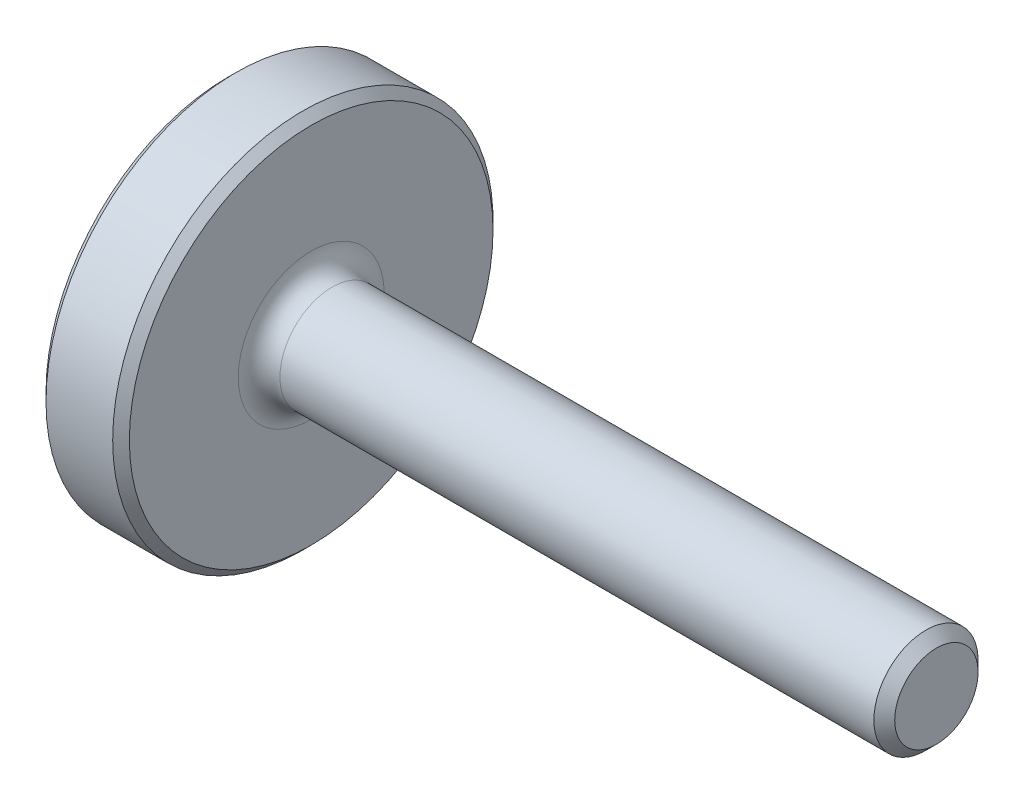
SolidWorks part; units mm, degrees
ref_plane "Plane1" through (0, 0, 0) normal (0, 0, 1) x (1, 0, 0)
ref_plane "Plane2" through (0, 0, 0) normal (0, 1, 0) x (1, 0, 0)
ref_plane "Plane3" through (0, 0, 0) normal (1, 0, 0) x (0, 0, -1)
sketch "BodySke" plane through (0, 0, 0) normal (0, 0, 1) x (1, 0, 0)
  line L0 (67, 5) -> (68, 4)
  line L1 (0, 0) -> (0, 17.45)
  line L2 (-11.4008, 0) -> (80.9761, 0) construction
  line L3 (68, 0) -> (0, 0)
  line L5 (68, 4) -> (68, 0)
  line L6 (0.8, 18.25) -> (7.2, 18.25)
  line L7 (4, 31.75) -> (4, -6.35) construction
  line L8 (0.8, 18.25) -> (0, 17.45)
  line L9 (10, 6.5875) -> (10, -2.9375) construction
  line L10 (18, 6.35) -> (18, -3.175) construction
  line L11 (7.2, 18.25) -> (8, 17.45)
  line L14 (8, 5) -> (67, 5)
  line L15 (8, 5) -> (8, 17.45)
  point P9 (68, 5)
  dimension "D1" = 45
  dimension "Head_ht" = 8
  dimension "D4" = 45
  dimension "Diameter" = 10
  dimension "Length" = 60
  dimension "Head_dia" = 36.5
  dimension "Advance" = 2
  dimension "Thread_nom" = 50
  dimension "Chamfer" = 0.8
  dimension "Minor_dia" = 8
revolve "Base-Revolve" add sketch "BodySke"
fillet "Fillet2" radius 2 1 edges at (8, 0, 5)
sketch "UcutSke" plane through (0, 0, 0) normal (0, 0, 1) x (1, 0, 0)
  line L0 (14, 5) -> (14, 4.5)
  line L1 (14.5, 4) -> (15.134, 4)
  line L2 (15.384, 4.067) -> (17, 5)
  line L3 (-5.0411, 0) -> (27.7823, 0) construction
  line L5 (14, 5) -> (17, 5)
  line L6 (8, -17.45) -> (8, 17.45) construction
  arc A0 (14.5, 4) -> (14, 4.5) centre (14.5, 4.5) cw
  arc A1 (15.384, 4.067) -> (15.134, 4) centre (15.134, 4.5) cw
  dimension "UcutRad" = 0.5
  dimension "D2" = 30
  dimension "Minor" = 8
  dimension "Diameter" = 10
  dimension "Neck" = 3
  dimension "e" = 6
revolve "UnderCut" [suppressed] cut sketch "UcutSke" angle 360 about L3
sketch "ThdSchSke" plane through (0, 0, 0) normal (0, 0, 1) x (1, 0, 0)
  line L0 (17, -4) -> (16.2998, -5)
  line L1 (17, -4) -> (17.7002, -5)
  line L2 (17.7002, -5) -> (17.7002, -6.25)
  line L3 (-3.175, 0) -> (5.1513, 0) construction
  line L5 (17.7002, -6.25) -> (16.2998, -6.25)
  line L6 (16.2998, -6.25) -> (16.2998, -5)
  line L8 (8, -17.45) -> (8, 17.45) construction
  dimension "Thread_minor" = 8
  dimension "Diameter" = 10
  dimension "Start" = 9
  dimension "SideAngle" = 55
  dimension "VeeAngle" = 70
  dimension "Overcut" = 12.5
revolve "ThreadSchematic" [suppressed] cut sketch "ThdSchSke" angle 360 about L3
pattern_linear "ThdSchPat" [suppressed]
sketch "KnurlSke" plane through (0, 0, 0) normal (-1, 0, 0) x (0, 0, 1)
  line L0 (0, 17.65) -> (0, 3.175) construction
  line L1 (0, 17.65) -> (0.3445, 18.2467)
  line L2 (0, 17.65) -> (-0.3445, 18.2467)
  line L3 (0, 18.25) -> (0, 17.65) construction
  circle A0 centre (0, 0) radius 18.25 construction
  arc A1 (0.3445, 18.2467) -> (-0.3445, 18.2467) centre (0, 0) ccw
  dimension "Depth" = 0.6
  dimension "vee-angle" = 60
extrude "Knurl_cut" [suppressed] cut sketch "KnurlSke" against normal up to next
pattern_circular "Knurl" [suppressed] count 86 over 360
sketch "Sketch1" plane through (68, 0, 0) normal (1, 0, 0) x (0, 0, -1)
  circle A0 centre (0, 0) radius 0.5
  dimension "D1" = 1
extrude "Nothing" add sketch "Sketch1" against normal blind 2
equation "\"Thread_minor@ThreadCosmetic\" = \"Minor_dia@BodySke\""
equation "\"Thread_minor@ThdSchSke\" = \"Thread_minor@ThreadCosmetic\""
equation "\"Diameter@ThdSchSke\" = \"Diameter@BodySke\""
equation "\"Overcut@ThdSchSke\" = \"Diameter@BodySke\" * 1.25"
equation "\"Start@ThdSchSke\" =  \"e@UcutSke\" + \"neck@UcutSke\""
equation "\"Thread_length@ThreadCosmetic\" = \"Length@BodySke\" - \"Start@ThdSchSke\""
equation "\"Num_threads@ThdSchPat\" = int( \"Thread_length@ThreadCosmetic\" / \"Advance@BodySke\" + 0.999 )  + 1"
equation "\"Advance@ThdSchPat\" = \"Thread_length@ThreadCosmetic\" /  (\"Num_threads@ThdSchPat\" - 1) 'relax it"
equation "\"depth@KnurlSke\" = \"Chamfer@BodySke\" * 0.75"
equation "\"Count@Knurl\" = (3.141592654 / 2 * \"Head_dia@BodySke\") / \"depth@KnurlSke\" * 0.9"
equation "\"Minor@UcutSke\" = \"Minor_dia@BodySke\""
equation "\"Diameter@UcutSke\" = \"Diameter@BodySke\""
